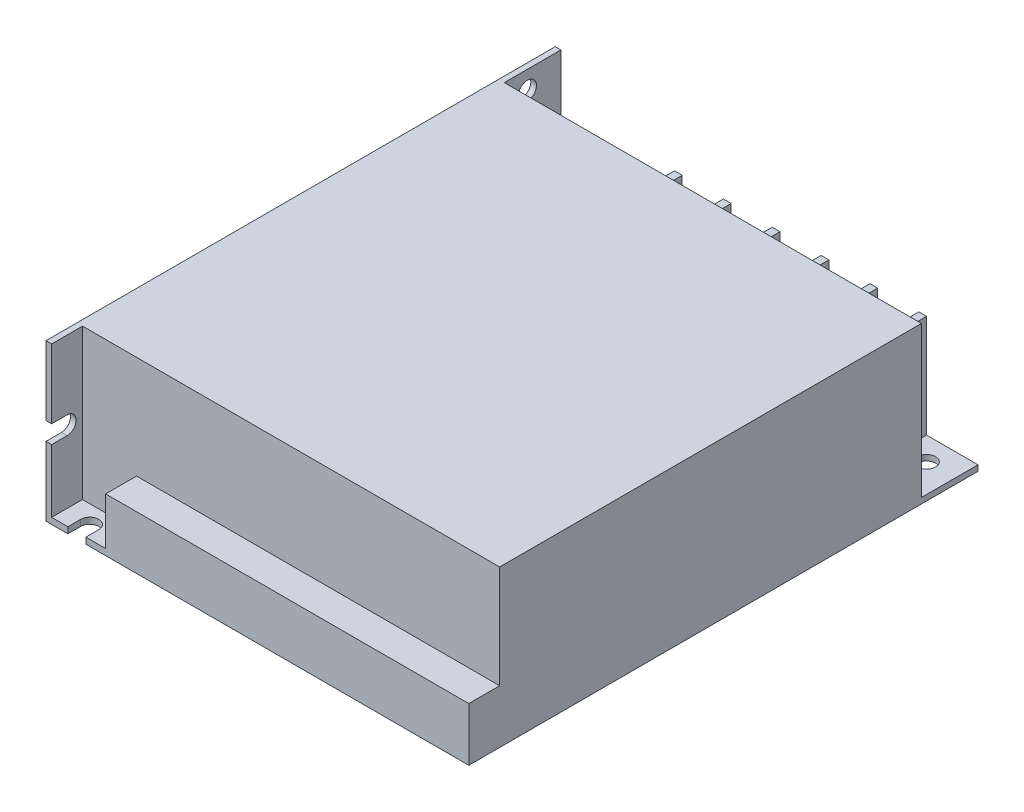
SolidWorks part; units mm, degrees
ref_plane "前基準面" through (0, 0, 0) normal (0, 0, 1) x (1, 0, 0)
ref_plane "上基準面" through (0, 0, 0) normal (0, 1, 0) x (1, 0, 0)
ref_plane "右基準面" through (0, 0, 0) normal (1, 0, 0) x (0, 0, -1)
sketch "草圖1" plane through (0, 0, 0) normal (0, 1, 0) x (1, 0, 0)
  line L1 (0, 0) -> (82.2, 0)
  line L2 (0, 0) -> (0, 99)
  line L3 (0, 99) -> (82.2, 99)
  line L4 (82.2, 0) -> (82.2, 99)
  dimension "D1" = 82.2
  dimension "D2" = 99
extrude "填料-伸長1" add sketch "草圖1" along normal blind 30.4
sketch "草圖3" plane through (0, 30.4, 0) normal (0, 1, 0) x (1, 0, 0)
  line L0 (0, 99) -> (0, 0) construction
  line L1 (82.2, 0) -> (1.1, 0)
  line L2 (82.2, 0) -> (82.2, 6)
  line L3 (82.2, 6) -> (1.1, 6)
  line L4 (1.1, 0) -> (1.1, 6)
  dimension "D1" = 6
  dimension "D2" = 1.1
extrude "除料-伸長1" cut sketch "草圖3" against normal blind 20
sketch "草圖4" plane through (0, 0, 0) normal (0, -1, 0) x (1, 0, 0)
  line L0 (0, -99) -> (0, 0) construction
  line L1 (0, 0) -> (82.2, 0) construction
  line L2 (82.2, -99) -> (0, -99) construction
  circle A0 centre (40.5, -23.5) radius 1.5
  circle A1 centre (40.5, -78.5) radius 1.5
  dimension "D4" = 3
  dimension "D5" = 3
  dimension "D1" = 40.5
  dimension "D2" = 23.5
  dimension "D3" = 20.5
extrude "除料-伸長2" cut sketch "草圖4" against normal blind 3
sketch "草圖5" plane through (0, 0, 0) normal (0, -1, 0) x (1, 0, 0)
  line L0 (82.2, -99) -> (0, -99) construction
  line L1 (82.2, 0) -> (82.2, -99) construction
  circle A0 centre (76.7, -94.5) radius 1.75
  dimension "D3" = 3.5
  dimension "D1" = 4.5
  dimension "D2" = 5.5
extrude "除料-伸長3" cut sketch "草圖5" against normal through all
sketch "草圖6" plane through (0, 30.4, 0) normal (0, 1, 0) x (1, 0, 0)
  line L1 (82.2, 99) -> (1.1, 99)
  line L2 (82.2, 99) -> (82.2, 88)
  line L3 (82.2, 88) -> (1.1, 88)
  line L4 (1.1, 99) -> (1.1, 88)
  line L5 (0, 99) -> (0, 0) construction
  dimension "D1" = 11
  dimension "D2" = 1.1
extrude "除料-伸長4" cut sketch "草圖6" against normal blind 29.3
sketch "草圖7" plane through (0, 0, 0) normal (-1, 0, 0) x (0, 0, 1)
  line L0 (0, 15.2) -> (-99, 15.2) construction
  line L1 (0, 30.4) -> (0, 0) construction
  line L2 (-99, 30.4) -> (-99, 0) construction
  line L3 (-3, 16.95) -> (0, 16.95)
  line L4 (0, 16.95) -> (0, 13.45)
  line L5 (0, 13.45) -> (-3, 13.45)
  circle A0 centre (-89, 15.2) radius 1.75
  circle A1 centre (-15, 15.2) radius 1.75
  arc A2 (-3, 16.95) -> (-3, 13.45) centre (-3, 15.2) ccw
  dimension "D1" = 3.5
  dimension "D2" = 3.5
  dimension "D5" = 3.5
  dimension "D3" = 15
  dimension "D4" = 10
  dimension "D6" = 3
extrude "除料-伸長5" cut sketch "草圖7" against normal blind 3
sketch "草圖8" plane through (0, 1.1, 0) normal (0, 1, 0) x (1, 0, 0)
  line L0 (82.2, 99) -> (1.1, 99) construction
  line L1 (72.2, 99) -> (23.2, 99)
  line L2 (72.2, 99) -> (72.2, 88)
  line L3 (72.2, 88) -> (23.2, 88)
  line L4 (23.2, 99) -> (23.2, 88)
  line L5 (1.1, 88) -> (82.2, 88) construction
  line L6 (82.2, 88) -> (82.2, 99) construction
  dimension "D1" = 49
  dimension "D2" = 10
extrude "填料-伸長2" add sketch "草圖8" along normal blind 20
sketch "草圖9" plane through (0, 1.1, 0) normal (0, 1, 0) x (1, 0, 0)
  line L1 (1.1, 99) -> (23.2, 99)
  line L2 (1.1, 99) -> (1.1, 88)
  line L3 (1.1, 88) -> (23.2, 88)
  line L4 (23.2, 99) -> (23.2, 88)
extrude "填料-伸長3" add sketch "草圖9" along normal blind 5.5
sketch "草圖10" plane through (0, 21.1, 0) normal (0, 1, 0) x (1, 0, 0)
  line L0 (72.2, 99) -> (23.2, 99) construction
  line L1 (24.7, 99) -> (32.7, 99)
  line L2 (24.7, 99) -> (24.7, 88)
  line L3 (24.7, 88) -> (32.7, 88)
  line L4 (32.7, 99) -> (32.7, 88)
  line L6 (34.2, 99) -> (42.2, 99)
  line L7 (34.2, 99) -> (34.2, 88)
  line L8 (34.2, 88) -> (42.2, 88)
  line L9 (42.2, 99) -> (42.2, 88)
  line L10 (43.7, 99) -> (51.7, 99)
  line L11 (43.7, 99) -> (43.7, 88)
  line L12 (43.7, 88) -> (51.7, 88)
  line L13 (51.7, 99) -> (51.7, 88)
  line L14 (53.2, 99) -> (61.2, 99)
  line L15 (53.2, 99) -> (53.2, 88)
  line L16 (53.2, 88) -> (61.2, 88)
  line L17 (61.2, 99) -> (61.2, 88)
  line L18 (62.7, 99) -> (70.7, 99)
  line L19 (62.7, 99) -> (62.7, 88)
  line L20 (62.7, 88) -> (70.7, 88)
  line L21 (70.7, 99) -> (70.7, 88)
  line L23 (82.2, 88) -> (1.1, 88)
  line L24 (23.2, 99) -> (23.2, 88) construction
  dimension "D1" = 8
  dimension "D2" = 8
  dimension "D3" = 8
  dimension "D4" = 8
  dimension "D5" = 8
  dimension "D6" = 1.5
  dimension "D7" = 1.5
  dimension "D8" = 1.5
  dimension "D9" = 1.5
  dimension "D10" = 1.5
extrude "除料-伸長6" cut sketch "草圖10" against normal blind 8 contours L21 L19 M23 M25 | L17 L15 M23 M25 | L13 L11 M23 M25 | L9 L7 M23 M25 | L4 L2 M23 M25
sketch "草圖11" plane through (0, 13.1, 0) normal (0, 1, 0) x (1, 0, 0)
  line L0 (62.7, 88) -> (70.7, 99) construction
  line L1 (53.2, 88) -> (61.2, 99) construction
  line L2 (70.7, 88) -> (62.7, 99) construction
  line L3 (53.2, 99) -> (61.2, 88) construction
  line L5 (43.7, 88) -> (51.7, 99) construction
  line L7 (43.7, 99) -> (51.7, 88) construction
  line L10 (34.2, 99) -> (42.2, 88) construction
  line L12 (34.2, 88) -> (42.2, 99) construction
  line L14 (24.7, 99) -> (32.7, 88) construction
  line L16 (24.7, 88) -> (32.7, 99) construction
  circle A0 centre (66.7, 93.5) radius 3.25
  circle A1 centre (57.2, 93.5) radius 3.25
  circle A2 centre (47.7, 93.5) radius 3.25
  circle A3 centre (38.2, 93.5) radius 3.25
  circle A4 centre (28.7, 93.5) radius 3.25
  dimension "D1" = 6.5
  dimension "D2" = 6.5
  dimension "D3" = 6.5
  dimension "D4" = 6.5
  dimension "D5" = 6.5
extrude "填料-伸長4" add sketch "草圖11" along normal blind 4.5
fillet "圓角1" radius 2 5 edges at (28.7, 17.6, -90.25) (38.2, 17.6, -90.25) (47.7, 17.6, -90.25) (57.2, 17.6, -90.25) (66.7, 17.6, -90.25)
sketch "草圖12" plane through (0, 0, 0) normal (-1, 0, 0) x (0, 0, 1)
  line L0 (-99, 30.4) -> (-99, 0) construction
  line L1 (-99, 30.4) -> (0, 30.4) construction
  circle A0 centre (-92.5, 26.8) radius 1.75
  point P6 (-96.2868, 25.2584)
  dimension "D3" = 3.5
  dimension "D1" = 6.5
  dimension "D2" = 3.6
extrude "除料-伸長7" cut sketch "草圖12" against normal blind 4.5
sketch "草圖13" plane through (0, 10.4, 0) normal (0, 1, 0) x (1, 0, 0)
  line L0 (82.2, 6) -> (1.1, 6) construction
  line L1 (1.1, 0) -> (11.6, 0)
  line L2 (1.1, 0) -> (1.1, 6)
  line L3 (1.1, 6) -> (11.6, 6)
  line L4 (11.6, 0) -> (11.6, 6)
  dimension "D1" = 10.5
extrude "除料-伸長8" cut sketch "草圖13" against normal blind 9.2
sketch "草圖14" plane through (0, 0, 0) normal (0, -1, 0) x (1, 0, 0)
  line L0 (0, -99) -> (0, 0) construction
  line L1 (0, 0) -> (82.2, 0) construction
  line L2 (7.75, -2.5) -> (7.75, 0)
  line L3 (7.75, 0) -> (4.25, 0)
  line L4 (4.25, 0) -> (4.25, -2.5)
  arc A0 (4.25, -2.5) -> (7.75, -2.5) centre (6, -2.5) ccw
  dimension "D1" = 3.5
  dimension "D2" = 6
  dimension "D3" = 2.5
extrude "除料-伸長9" cut sketch "草圖14" against normal through all
